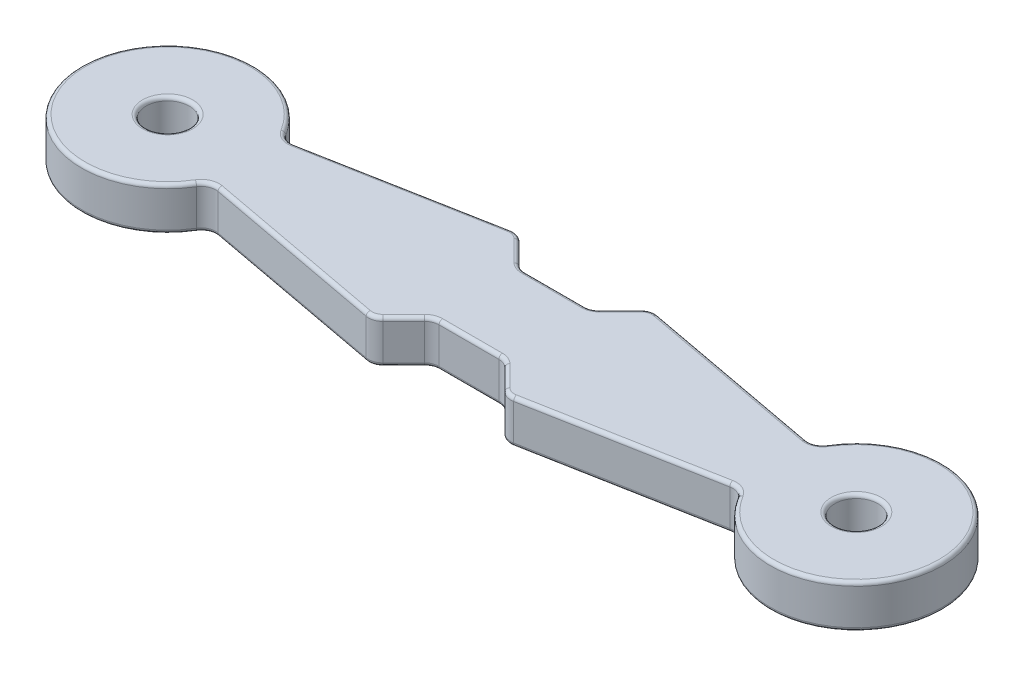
SolidWorks part; units mm, degrees
ref_plane "Ebene vorne" through (0, 0, 0) normal (0, 0, 1) x (1, 0, 0)
ref_plane "Ebene oben" through (0, 0, 0) normal (0, 1, 0) x (1, 0, 0)
ref_plane "Ebene rechts" through (0, 0, 0) normal (1, 0, 0) x (0, 0, -1)
sketch "Skizze1" plane through (0, 0, 0) normal (0, 1, 0) x (1, 0, 0)
  line L0 (0, 0) -> (24, 0) construction
  line L1 (24, 0) -> (24, 3) construction
  line L2 (26.5, 3) -> (21.5, 3)
  line L3 (24, 0) -> (48, 0) construction
  line L4 (21.5, 3) -> (19.3787, 5.1213)
  line L5 (19.3787, 5.1213) -> (5.446, 2.5182)
  line L6 (28.6213, 5.1213) -> (42.554, 2.5182)
  line L7 (26.5, 3) -> (28.6213, 5.1213)
  line L8 (19.3787, -5.1213) -> (5.446, -2.5182)
  line L9 (21.5, -3) -> (19.3787, -5.1213)
  line L10 (26.5, -3) -> (21.5, -3)
  line L11 (26.5, -3) -> (28.6213, -5.1213)
  line L12 (28.6213, -5.1213) -> (42.554, -2.5182)
  arc A0 (5.446, 2.5182) -> (5.446, -2.5182) centre (0, 0) ccw
  arc A1 (42.554, -2.5182) -> (42.554, 2.5182) centre (48, 0) ccw
  circle A5 centre (0, 0) radius 1.5
  circle A6 centre (48, 0) radius 1.5
  point P32 (6, 0)
  dimension "D2" = 12
  dimension "D3" = 2.5
  dimension "D10" = 3
  dimension "D4" = 24
  dimension "D5" = 3
  dimension "D6" = 3
  dimension "D7" = 45
  dimension "D8" = 14.1738
extrude "Aufsatz-Linear austragen1" add sketch "Skizze1" along normal blind 3
fillet "Verrundung1" radius 1 12 edges at (28.6213, 1.5, -5.1213) (42.554, 1.5, -2.5182) (42.554, 1.5, 2.5182) (28.6213, 1.5, 5.1213) (26.5, 1.5, 3) (19.3787, 1.5, 5.1213) (5.446, 1.5, 2.5182) (5.446, 1.5, -2.5182) (19.3787, 1.5, -5.1213) (21.5, 1.5, -3) (26.5, 1.5, -3) (21.5, 1.5, 3)
fillet "Verrundung2" radius 0.25 52 edges at (42.4259, 0, -2.7226) (42.4259, 0, 2.7226) (28.6599, 0, 4.9968) (26.4685, 0, 3.0761) (21.5315, 0, 3.0761) (19.3401, 0, 4.9968) (5.5741, 0, 2.7226) (5.5741, 0, -2.7226) (19.3401, 0, -4.9968) (21.5315, 0, -3.0761) (26.4685, 0, -3.0761) (28.6599, 0, -4.9968) (5.5741, 3, 2.7226) (5.5741, 3, -2.7226) (19.3401, 3, -4.9968) (21.5315, 3, -3.0761) (26.4685, 3, -3.0761) (28.6599, 3, -4.9968) (42.4259, 3, -2.7226) (42.4259, 3, 2.7226) (28.6599, 3, 4.9968) (26.4685, 3, 3.0761) (21.5315, 3, 3.0761) (19.3401, 3, 4.9968) (48, 0, -1.5) (48, 3, -1.5) (0, 0, 1.5) (0, 3, 1.5) (27.5208, 0, -4.0208) (24, 0, -3) (20.4792, 0, -4.0208) (12.513, 0, -3.8386) (-6, 0, 0) (12.513, 0, 3.8386) (20.4792, 0, 4.0208) (24, 0, 3) (27.5208, 0, 4.0208) (35.487, 0, 3.8386) (54, 0, 0) (35.487, 0, -3.8386) (27.5208, 3, -4.0208) (24, 3, -3) (20.4792, 3, -4.0208) (12.513, 3, -3.8386) (-6, 3, 0) (20.4792, 3, 4.0208) (24, 3, 3) (27.5208, 3, 4.0208) (35.487, 3, 3.8386) (54, 3, 0) (35.487, 3, -3.8386) (12.513, 3, 3.8386)
